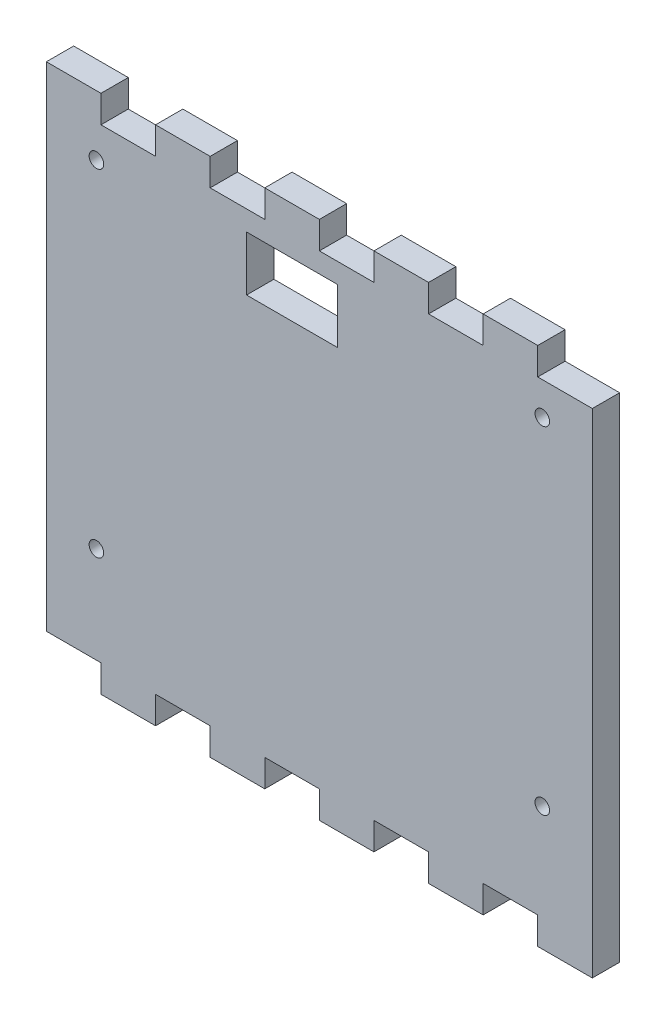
SolidWorks part; units mm, degrees
ref_plane "Plan de face" through (0, 0, 0) normal (0, 0, 1) x (1, 0, 0)
ref_plane "Plan de dessus" through (0, 0, 0) normal (0, 1, 0) x (1, 0, 0)
ref_plane "Plan de droite" through (0, 0, 0) normal (1, 0, 0) x (0, 0, -1)
sketch "Esquisse1" plane through (0, 0, 0) normal (0, 0, 1) x (1, 0, 0)
  line L1 (0, 0) -> (300, 0)
  line L2 (0, 0) -> (0, -286)
  line L3 (0, -286) -> (300, -286)
  line L4 (300, 0) -> (300, -286)
  dimension "D1" = 300
  dimension "D2" = 286
extrude "Boss.-Extru.1" add sketch "Esquisse1" along normal blind 15
sketch "Esquisse2" plane through (0, 0, 15) normal (0, 0, 1) x (1, 0, 0)
  line L0 (300, 0) -> (0, 0) construction
  line L1 (30, 0) -> (60, 0)
  line L2 (30, 0) -> (30, -15)
  line L3 (30, -15) -> (60, -15)
  line L4 (60, 0) -> (60, -15)
  line L5 (0, 0) -> (0, -286) construction
  dimension "D1" = 15
  dimension "D2" = 30
  dimension "D3" = 30
extrude "Enlèv. mat.-Extru.1" cut sketch "Esquisse2" against normal blind 41
pattern_linear "Répétition linéaire1" count 10 spacing 60 along (1, 0, 0) of "Enlèv. mat.-Extru.1"
sketch "Esquisse3" plane through (0, 0, 0) normal (0, 0, -1) x (-1, 0, 0)
  line L0 (-30, 0) -> (0, 0) construction
  line L1 (0, 0) -> (0, -286) construction
  line L2 (0, 0) -> (0, -286) construction
  circle A0 centre (-272.5, -33) radius 17.5 construction
  circle A1 centre (-27.5, -33) radius 17.5 construction
  circle A2 centre (-272.5, -218) radius 17.5 construction
  circle A3 centre (-27.5, -218) radius 17.5 construction
  circle A4 centre (-272.5, -33) radius 4
  circle A5 centre (-27.5, -33) radius 4
  circle A6 centre (-27.5, -218) radius 4
  circle A7 centre (-272.5, -218) radius 4
  circle A8 centre (-150, -33) radius 4 construction
  circle A9 centre (-150, -218) radius 4 construction
  dimension "D1" = 35
  dimension "D4" = 27.5
  dimension "D5" = 33
  dimension "D6" = 8
  dimension "D2" = 245
  dimension "D3" = 185
  dimension "D7" = 150
extrude "Enlèv. mat.-Extru.2" cut sketch "Esquisse3" against normal through all
sketch "Esquisse5" plane through (0, 0, 15) normal (0, 0, 1) x (1, 0, 0)
  line L1 (30, -231) -> (280, -231)
  line L2 (30, -231) -> (30, -271)
  line L3 (30, -271) -> (280, -271)
  line L4 (280, -231) -> (280, -271)
  line L5 (0, 0) -> (0, -286) construction
  line L6 (0, -286) -> (300, -286) construction
  point P4 (30, -251)
  dimension "D1" = 40
  dimension "D2" = 35
  dimension "D3" = 250
  dimension "D4" = 30
sketch "Esquisse6" plane through (0, 0, 0) normal (0, 0, -1) x (-1, 0, 0)
  line L0 (0, -143) -> (-300, -143) construction
  line L1 (0, 0) -> (0, -286) construction
  line L2 (-300, -286) -> (-300, -15) construction
ref_plane "Plan1" through (0, -143, 0) normal (0, -1, 0) x (-1, 0, 0)
sketch "Esquisse7" plane through (0, 0, 0) normal (0, 0, -1) x (-1, 0, 0)
  line L0 (-300, -286) -> (-270, -286)
  line L1 (0, -286) -> (-300, -286) construction
  line L2 (-270, -286) -> (-270, -271)
  line L3 (-270, -271) -> (-240, -271)
  line L4 (-240, -271) -> (-240, -286)
  line L5 (-240, -286) -> (-270, -286)
  dimension "D1" = 30
  dimension "D2" = 15
  dimension "D3" = 30
extrude "Enlèv. mat.-Extru.3" cut sketch "Esquisse7" against normal through all contours L4 L3 L2 M24
pattern_linear "Répétition linéaire2" count 5 spacing 60 along (-1, 0, 0) of "Enlèv. mat.-Extru.3"
sketch "Esquisse8" plane through (0, 0, 0) normal (0, 0, -1) x (-1, 0, 0)
  line L0 (-150, -15) -> (-180, -15) construction
  line L1 (-160, -26) -> (-110, -26)
  line L2 (-160, -26) -> (-160, -56)
  line L3 (-160, -56) -> (-110, -56)
  line L4 (-110, -26) -> (-110, -56)
  line L6 (-300, -286) -> (-300, -15) construction
  point P6 (-165, -15)
  dimension "D1" = 30
  dimension "D2" = 11
  dimension "D3" = 50
  dimension "D4" = 140
extrude "Enlèv. mat.-Extru.4" cut sketch "Esquisse8" against normal through all
